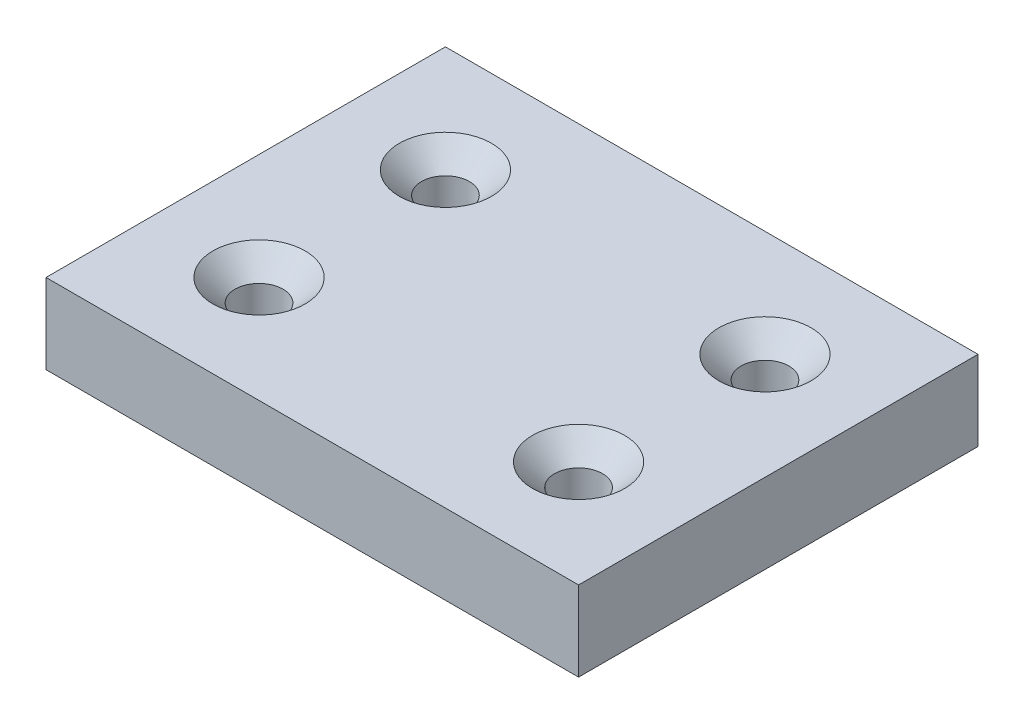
SolidWorks part; units mm, degrees
ref_plane "Front Plane" through (0, 0, 0) normal (0, 0, 1) x (1, 0, 0)
ref_plane "Top Plane" through (0, 0, 0) normal (0, 1, 0) x (1, 0, 0)
ref_plane "Right Plane" through (0, 0, 0) normal (1, 0, 0) x (0, 0, -1)
sketch "Sketch1" plane through (0, 0, 0) normal (0, 1, 0) x (1, 0, 0)
  line L1 (-50, -37.5) -> (50, -37.5)
  line L2 (-50, -37.5) -> (-50, 37.5)
  line L3 (-50, 37.5) -> (50, 37.5)
  line L4 (50, -37.5) -> (50, 37.5)
  line L5 (-50, -37.5) -> (50, 37.5) construction
  line L6 (-50, 37.5) -> (50, -37.5) construction
  point P0 (0, 0)
  dimension "D1" = 100
  dimension "D2" = 75
extrude "Boss-Extrude1" add sketch "Sketch1" along normal blind 15
hole_wizard "CSK for M8 Flat Head Machine Screw1" positions "Sketch2" profile "Sketch3" countersink size "M8" standard "ANSI Metric"
sketch "Sketch2" plane through (0, 15, 0) normal (0, 1, 0) x (-1, 0, 0)
  line L0 (50, 37.5) -> (-50, 37.5) construction
  line L1 (-50, -37.5) -> (50, -37.5) construction
  line L2 (-50, 37.5) -> (-50, -37.5) construction
  line L3 (50, -37.5) -> (50, 37.5) construction
  point P0 (30, 17.5)
  point P2 (30, -17.5)
  point P4 (-30, -17.5)
  point P6 (-30, 17.5)
  dimension "D1" = 20
  dimension "D2" = 20
  dimension "D3" = 20
  dimension "D4" = 20
  dimension "D5" = 20
sketch "Sketch3" plane through (-30, 15, 17.5) normal (1, 0, 0) x (0, 0, 1)
  line L0 (0, 0) -> (0, 15)
  line L1 (0, 15) -> (4.5, 15)
  line L2 (4.5, 15) -> (4.5, 4.15)
  line L3 (4.5, 4.15) -> (8.65, 0)
  line L5 (8.65, 0) -> (0, 0)
  line L6 (-4.5, 4.15) -> (-8.65, 0) construction
  line L11 (0, -6.35) -> (0, 107.95) construction
  dimension "Thru Hole Dia." = 9
  dimension "Thru Hole Depth" = 15
  dimension "Near C'Sink Dia." = 17.3
  dimension "Near C'Sink Angle" = 90
